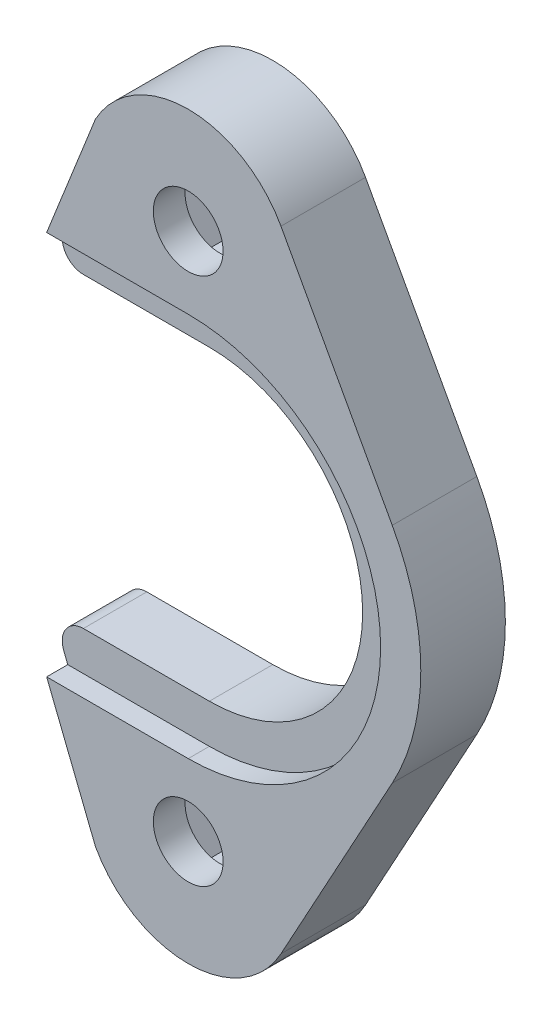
SolidWorks part; units mm, degrees
ref_plane "Спереди" through (0, 0, 0) normal (0, 0, 1) x (1, 0, 0)
ref_plane "Сверху" through (0, 0, 0) normal (0, 1, 0) x (1, 0, 0)
ref_plane "Справа" through (0, 0, 0) normal (1, 0, 0) x (0, 0, -1)
sketch "Эскиз1" plane through (0, 0, 0) normal (0, 0, 1) x (1, 0, 0)
  line L0 (9.65, 5.2799) -> (4.3864, 14.9002)
  line L1 (-7.4321, 7.25) -> (-4.3864, 14.9002)
  line L2 (-7.4321, -7.25) -> (-4.3864, -14.9002)
  line L3 (9.65, -5.2799) -> (4.3864, -14.9002)
  line L4 (0, 17.7503) -> (0, 0) construction
  line L5 (0, 0) -> (13.6473, 0) construction
  line L6 (0, 7.25) -> (-7.4321, 7.25)
  line L7 (0, -7.25) -> (-7.4321, -7.25)
  arc A1 (4.3864, 14.9002) -> (-4.3864, 14.9002) centre (0, 12.5002) ccw
  circle A2 centre (0, -12.5002) radius 1.65
  arc A3 (4.3864, -14.9002) -> (-4.3864, -14.9002) centre (0, -12.5002) cw
  arc A4 (9.65, -5.2799) -> (9.65, 5.2799) centre (0, 0) ccw
  circle A5 centre (0, 12.5002) radius 1.65
  arc A6 (0, -7.25) -> (0, 7.25) centre (0, 0) ccw
  dimension "D1" = 25.0004
  dimension "D2" = 11
  dimension "D3" = 5
  dimension "D4" = 3.3
  dimension "D5" = 14.5
extrude "Бобышка-Вытянуть1" add sketch "Эскиз1" against normal blind 4
sketch "Эскиз2" plane through (0, 0, -4) normal (0, 0, -1) x (-1, 0, 0)
  line L0 (0, 0) -> (14.9363, 0) construction
  line L1 (3.2909, 12.5002) -> (1.6454, 15.3502)
  line L2 (1.6454, 15.3502) -> (-1.6454, 15.3502)
  line L3 (-1.6454, 15.3502) -> (-3.2909, 12.5002)
  line L4 (-3.2909, 12.5002) -> (-1.6454, 9.6502)
  line L5 (-1.6454, 9.6502) -> (1.6454, 9.6502)
  line L6 (1.6454, 9.6502) -> (3.2909, 12.5002)
  line L7 (1.6454, -9.6502) -> (3.2909, -12.5002)
  line L8 (-1.6454, -9.6502) -> (1.6454, -9.6502)
  line L9 (-3.2909, -12.5002) -> (-1.6454, -9.6502)
  line L10 (-1.6454, -15.3502) -> (-3.2909, -12.5002)
  line L11 (1.6454, -15.3502) -> (-1.6454, -15.3502)
  line L12 (3.2909, -12.5002) -> (1.6454, -15.3502)
  circle A0 centre (0, 12.5002) radius 2.85 construction
  circle A1 centre (0, -12.5002) radius 2.85 construction
  dimension "D1" = 5.7
extrude "Вырез-Вытянуть1" cut sketch "Эскиз2" against normal blind 2.5
sketch "Эскиз3" plane through (0, 0, 0) normal (0, 0, 1) x (1, 0, 0)
  line L0 (0, 9.1) -> (-9.1, 9.1)
  line L1 (-9.1, 9.1) -> (-9.1, -9.1)
  line L2 (-9.1, -9.1) -> (0, -9.1)
  arc A0 (0, -9.1) -> (0, 9.1) centre (0, 0) ccw
  dimension "D1" = 18.2
extrude "Вырез-Вытянуть2" cut sketch "Эскиз3" against normal blind 1
fillet "Скругление1" radius 1 2 edges at (-7.4321, 7.25, -2.5) (-7.4321, -7.25, -2.5)
